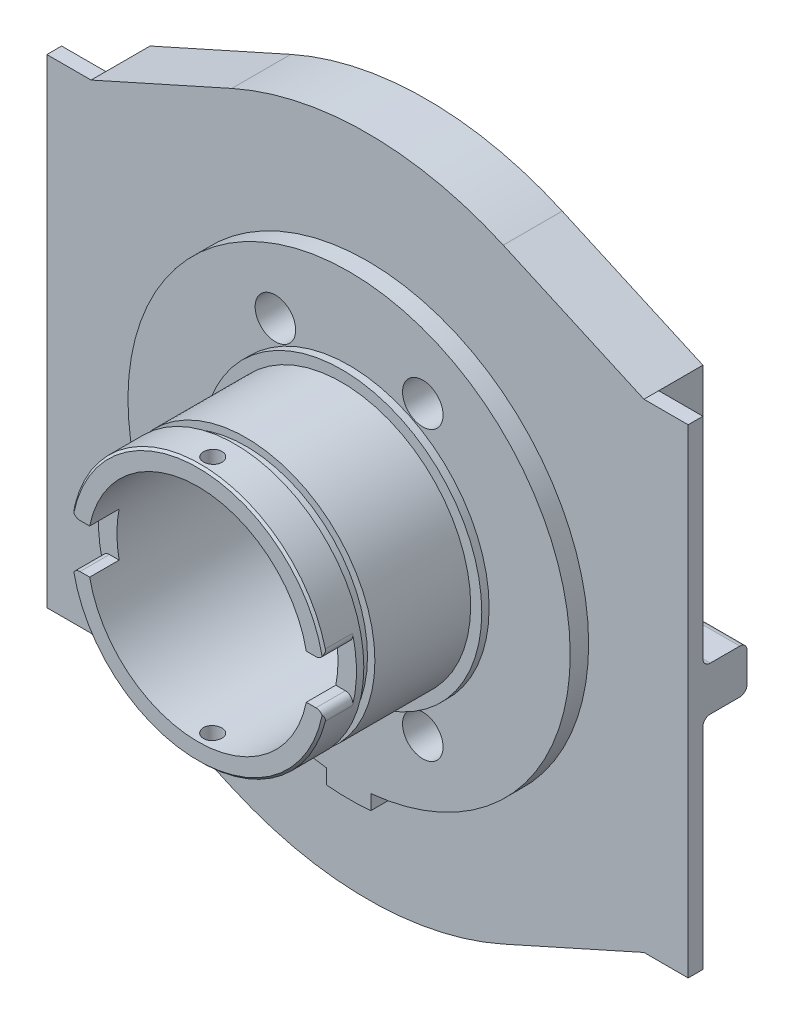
SolidWorks part; units mm, degrees
ref_plane "前视基准面" through (0, 0, 0) normal (0, 0, 1) x (1, 0, 0)
ref_plane "上视基准面" through (0, 0, 0) normal (0, 1, 0) x (1, 0, 0)
ref_plane "右视基准面" through (0, 0, 0) normal (1, 0, 0) x (0, 0, -1)
sketch "草图1" plane through (0, 0, 0) normal (0, 0, 1) x (1, 0, 0)
  line L0 (-18.4151, 41.0595) -> (-37.5, 32.5)
  line L1 (-37.5, 32.5) -> (-37.5, -32.5) construction
  line L2 (-37.5, -32.5) -> (-18.4151, -41.0595)
  line L3 (0, 0) -> (-66.7946, 0) construction
  line L4 (0, 0) -> (0, 35.1544) construction
  line L5 (37.5, -32.5) -> (18.4151, -41.0595)
  line L6 (37.5, 32.5) -> (37.5, -32.5) construction
  line L7 (18.4151, 41.0595) -> (37.5, 32.5)
  line L8 (-37.5, 32.5) -> (-43.5, 32.5)
  line L9 (-43.5, 32.5) -> (-43.5, -32.5)
  line L10 (-43.5, -32.5) -> (-37.5, -32.5)
  line L11 (43.5, -32.5) -> (37.5, -32.5)
  line L12 (43.5, 32.5) -> (43.5, -32.5)
  line L13 (37.5, 32.5) -> (43.5, 32.5)
  arc A0 (-18.4151, -41.0595) -> (18.4151, -41.0595) centre (0, 0) ccw
  arc A1 (18.4151, 41.0595) -> (-18.4151, 41.0595) centre (0, 0) ccw
  circle A2 centre (0, 0) radius 15
  point P12 (37.5, 0)
  dimension "D1" = 45
  dimension "D4" = 30
  dimension "D2" = 65
  dimension "D3" = 75
  dimension "D5" = 6
extrude "凸台-拉伸1" add sketch "草图1" along normal mid plane 8
sketch "草图2" plane through (0, 0, 4) normal (0, 0, 1) x (1, 0, 0)
  line L1 (-10, -19.5) -> (10, -19.5) construction
  line L2 (-10, -19.5) -> (-10, 19.5) construction
  line L3 (-10, 19.5) -> (10, 19.5) construction
  line L4 (10, -19.5) -> (10, 19.5) construction
  line L5 (-10, -19.5) -> (10, 19.5) construction
  line L6 (-10, 19.5) -> (10, -19.5) construction
  point P0 (0, 0)
  dimension "D1" = 20
  dimension "D2" = 39
hole_wizard "M3 螺纹孔1" positions "3D草图1" profile "草图3" tap size "M3" standard "GB"
sketch3d "3D草图1"
  point P0 (-10, 19.5, 4)
  point P3 (10, 19.5, 4)
  point P6 (-10, -19.5, 4)
  point P9 (10, -19.5, 4)
sketch "草图3" plane through (-10, 19.5, 4) normal (1, 0, 0) x (0, -1, 0)
  line L0 (0, 0) -> (0, 8)
  line L1 (0, 8) -> (1.25, 8)
  line L2 (1.25, 8) -> (1.25, 0)
  line L5 (1.25, 0) -> (0, 0)
  line L11 (0, -6.35) -> (0, 107.95) construction
  dimension "通孔螺纹孔钻头直径" = 2.5
  dimension "通孔螺纹孔钻头深度" = 8
sketch "草图4" plane through (0, 0, 4) normal (0, 0, 1) x (1, 0, 0)
  circle A0 centre (0, 0) radius 17.5
  circle A1 centre (0, 0) radius 15 construction
  circle A2 centre (0, 0) radius 27.5 construction
  circle A3 centre (0, 0) radius 15
  dimension "D1" = 2.5
  dimension "D2" = 55
  dimension "D3" = 35
extrude "凸台-拉伸2" add sketch "草图4" along normal blind 23
sketch "草图5" plane through (0, 0, 4) normal (0, 0, 1) x (1, 0, 0)
  circle A0 centre (0, 0) radius 19
  circle A1 centre (0, 0) radius 17.5 construction
  circle A2 centre (0, 0) radius 17.5
  dimension "D1" = 38
extrude "凸台-拉伸3" add sketch "草图5" along normal blind 3.5
sketch "草图6" plane through (0, 0, 0) normal (0, 1, 0) x (1, 0, 0)
  line L0 (-18.4151, 4) -> (-37.5, 4) construction
  line L1 (-43.5, -2) -> (-37.5, -2)
  line L2 (-43.5, -2) -> (-43.5, 4)
  line L3 (-43.5, 4) -> (-37.5, 4)
  line L4 (-37.5, -2) -> (-37.5, 4)
  line L5 (0, 0) -> (0, -16.5552) construction
  line L7 (37.5, -2) -> (37.5, 4)
  line L8 (43.5, 4) -> (37.5, 4)
  line L9 (43.5, -2) -> (43.5, 4)
  line L10 (43.5, -2) -> (37.5, -2)
  line L11 (-43.5, -4) -> (-43.5, 4) construction
  dimension "D1" = 6
  dimension "D2" = 6
extrude "切除-拉伸1" cut sketch "草图6" against normal through all both and the other way through all
sketch "草图9" plane through (0, 0, 0) normal (1, 0, 0) x (0, 0, -1)
  line L0 (0, 0) -> (14.7996, 0) construction
  line L3 (-4, -32.5) -> (-4, 32.5) construction
  circle A0 centre (2, 20) radius 1.45 construction
  circle A1 centre (2, -20) radius 1.45 construction
  dimension "D1" = 2.9
  dimension "D2" = 40
  dimension "D3" = 6
sketch "草图10" plane through (-37.5, 0, 0) normal (-1, 0, 0) x (0, 0, 1)
  point P0 (-2, 20)
  point P1 (-2, -20)
hole_wizard "M3 螺纹孔2" positions "3D草图2" profile "草图11" tap size "M3" standard "GB"
sketch3d "3D草图2"
  point P0 (-37.5, 20, -2)
  point P3 (-37.5, -20, -2)
sketch "草图11" plane through (-37.5, 20, -2) normal (0, 1, 0) x (0, 0, 1)
  line L0 (0, 0) -> (0, 7.2511)
  line L1 (0, 7.2511) -> (1.25, 6.5)
  line L2 (1.25, 6.5) -> (1.25, 0)
  line L5 (1.25, 0) -> (0, 0)
  line L10 (0, 7.2511) -> (-1.25, 6.5) construction
  line L11 (0, -6.35) -> (0, 107.95) construction
  dimension "螺纹孔钻头直径" = 2.5
  dimension "螺纹孔钻头深度" = 6.5
  dimension "导头角度" = 118
sketch "草图12" plane through (37.5, 0, 0) normal (1, 0, 0) x (0, 0, -1)
  point P0 (2, 20)
  point P1 (2, -20)
hole_wizard "M3 螺纹孔3" positions "3D草图3" profile "草图13" tap size "M3" standard "GB"
sketch3d "3D草图3"
  point P0 (37.5, 20, -2)
  point P3 (37.5, -20, -2)
sketch "草图13" plane through (37.5, 20, -2) normal (0, 1, 0) x (0, 0, -1)
  line L0 (0, 0) -> (0, 7.2511)
  line L1 (0, 7.2511) -> (1.25, 6.5)
  line L2 (1.25, 6.5) -> (1.25, 0)
  line L5 (1.25, 0) -> (0, 0)
  line L10 (0, 7.2511) -> (-1.25, 6.5) construction
  line L11 (0, -6.35) -> (0, 107.95) construction
  dimension "螺纹孔钻头直径" = 2.5
  dimension "螺纹孔钻头深度" = 6.5
  dimension "导头角度" = 118
sketch "草图14" plane through (-37.5, 0, 0) normal (-1, 0, 0) x (0, 0, 1)
  line L1 (-4, -32.5) -> (-4, 32.5) construction
  line L2 (-4, -3) -> (2, -3)
  line L3 (-4, -3) -> (-4, 3)
  line L4 (-4, 3) -> (2, 3)
  line L5 (2, -3) -> (2, 3)
  line L6 (-4, -3) -> (2, 3) construction
  line L7 (-4, 3) -> (2, -3) construction
  line L8 (2, -32.5) -> (2, 32.5) construction
  point P0 (-1, 0)
  dimension "D1" = 6
extrude "凸台-拉伸4" add sketch "草图14" along normal blind 6
fillet "圆角1" radius 1 4 edges at (-40.5, 3, 2) (-40.5, -3, 2) (-40.5, 3, -4) (-40.5, -3, -4)
mirror "镜向1" about plane through (0, 0, 0) normal (1, 0, 0) of "凸台-拉伸4"
fillet "圆角2" radius 1 4 edges at (40.5, 3, 2) (40.5, -3, 2) (40.5, -3, -4) (40.5, 3, -4)
sketch "回转半径" plane through (0, 0, 0) normal (0, 0, 1) x (1, 0, 0)
  circle A0 centre (0, 0) radius 54.3001
  dimension "D1" = 108.6002
chamfer "倒角1" distance 0.3 angle 45 1 edges at (17.5, 0, 27)
sketch "草图15" plane through (0, 0, 27) normal (0, 0, 1) x (1, 0, 0)
  line L1 (-18, 3) -> (-18, -3)
  line L2 (-18, 3) -> (18, 3)
  line L3 (18, 3) -> (18, -3)
  line L4 (-18, -3) -> (18, -3)
  line L5 (-18, 3) -> (18, -3) construction
  line L6 (18, 3) -> (-18, -3) construction
  point P0 (0, 0)
  dimension "D1" = 36
  dimension "D2" = 6
extrude "切除-拉伸2" cut sketch "草图15" against normal blind 4
ref_plane "基准面1" through (0, 0, 0) normal (0, 1, 0) x (1, 0, 0)
sketch "草图17" plane through (0, 0, 0) normal (0, 1, 0) x (1, 0, 0)
  line L0 (-17.5, -22) -> (-16.5, -22)
  line L1 (-17.5, -7.5) -> (-17.5, -23) construction
  line L2 (-16.5, -22) -> (-16.5, -20.5)
  line L3 (-16.5, -20.5) -> (-17.5, -20.5)
  line L4 (-17.5, -20.5) -> (-17.5, -22)
  line L5 (-16.9364, -27) -> (16.9364, -27) construction
  dimension "D1" = 1
  dimension "D2" = 1.5
  dimension "D3" = 5
revolve "切除-旋转1" cut sketch "草图17" angle 360 about axis through (0, 0, 4) along (0, 0, -1)
fillet "圆角7" radius 1 4 edges at (17.2409, -3, 24.85) (-17.2409, -3, 24.85) (-17.2409, 3, 24.85) (17.2409, 3, 24.85)
sketch "草图18" plane through (0, 0, 0) normal (0, 1, 0) x (1, 0, 0)
  line L0 (0, 0) -> (0, -36.8249) construction
  line L1 (0, -26.7) -> (0, -23) construction
  line L2 (0, -20.5) -> (0, -22) construction
  line L3 (-16.8487, -27) -> (16.8487, -27) construction
  circle A0 centre (0, -25) radius 1.25
  dimension "D1" = 2.5
  dimension "D2" = 2
extrude "切除-拉伸3" cut sketch "草图18" against normal mid plane 38
sketch "草图19" plane through (0, 0, 4) normal (0, 0, 1) x (1, 0, 0)
  circle A0 centre (10, 19.5) radius 2.75
  circle A1 centre (-10, 19.5) radius 2.75
  circle A2 centre (-10, -19.5) radius 2.75
  circle A3 centre (10, -19.5) radius 2.75
  dimension "D1" = 5.5
extrude "切除-拉伸4" cut sketch "草图19" against normal blind 1.5
sketch "草图20" plane through (0, 0, 4) normal (0, 0, 1) x (1, 0, 0)
  circle A0 centre (10, -19.5) radius 2.75 construction
  circle A1 centre (-10, -19.5) radius 2.75 construction
  circle A2 centre (10, 19.5) radius 2.75 construction
  circle A3 centre (-10, 19.5) radius 2.75 construction
  circle A4 centre (10, -19.5) radius 2.75
  circle A5 centre (-10, -19.5) radius 2.75
  circle A6 centre (10, 19.5) radius 2.75
  circle A7 centre (-10, 19.5) radius 2.75
  circle A8 centre (0, 0) radius 19
  circle A9 centre (0, 0) radius 30
  dimension "D1" = 60
extrude "凸台-拉伸5" add sketch "草图20" along normal blind 2.5
sketch "草图21" plane through (0, 0, 6.5) normal (0, 0, 1) x (1, 0, 0)
  line L0 (2.9492, 31.8638) -> (2.9492, 29.8547) construction
  line L1 (-0.0508, 30) -> (-0.0508, 40.8933) construction
  line L2 (-3.0508, 31.8542) -> (-3.0508, 29.8445) construction
  line L3 (0, 0) -> (79.4809, 0) construction
  line L4 (55, 0) -> (-55, 0) construction
  line L5 (-3.0508, -31.8542) -> (-3.0508, -29.8445)
  line L6 (2.9492, -31.8638) -> (2.9492, -29.8547)
  arc A0 (2.9492, 31.8638) -> (-3.0508, 31.8542) centre (0, 0) ccw construction
  circle A1 centre (0, 0) radius 30 construction
  arc A2 (2.9492, 29.8547) -> (-3.0508, 29.8445) centre (0, 0) ccw construction
  arc A3 (2.9492, -29.8547) -> (-3.0508, -29.8445) centre (0, 0) cw
  arc A4 (2.9492, -31.8638) -> (-3.0508, -31.8542) centre (0, 0) cw
  dimension "D1" = 64
  dimension "D2" = 3
  dimension "D3" = 3
extrude "凸台-拉伸6" add sketch "草图21" against normal up to surface (2.5 mm away)
